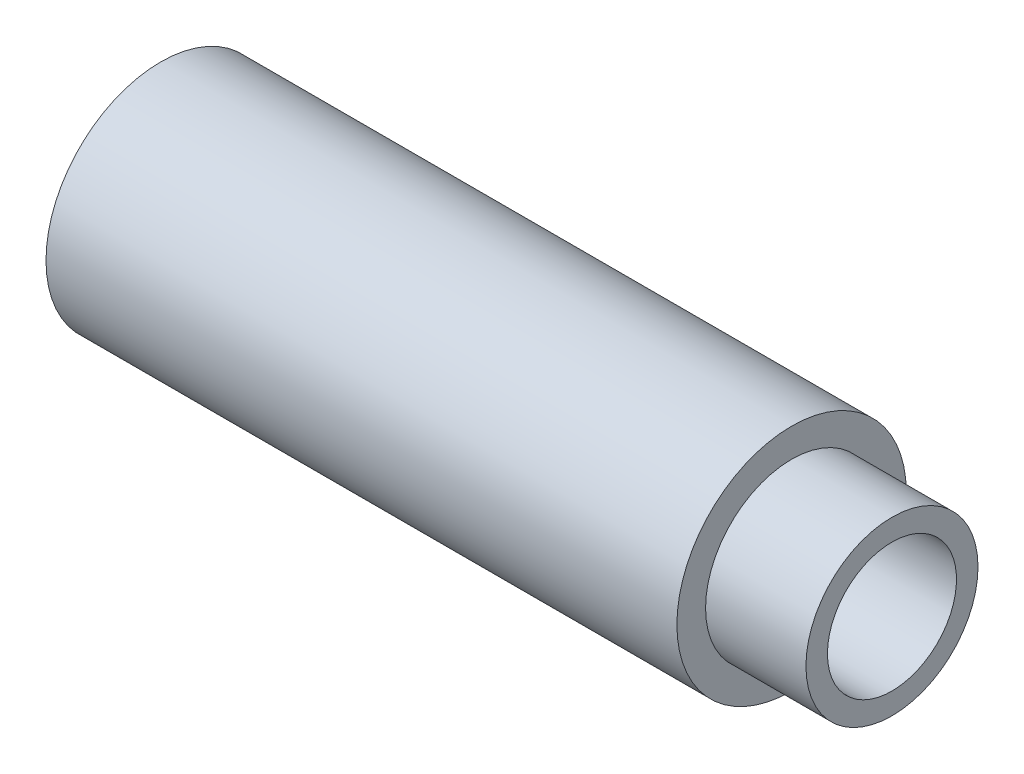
SolidWorks part; units mm, degrees
ref_plane "Front Plane" through (0, 0, 0) normal (0, 0, 1) x (1, 0, 0)
ref_plane "Top Plane" through (0, 0, 0) normal (0, 1, 0) x (1, 0, 0)
ref_plane "Right Plane" through (0, 0, 0) normal (1, 0, 0) x (0, 0, -1)
sketch "Sketch1" plane through (0, 0, 0) normal (0, 0, 1) x (1, 0, 0)
  line L0 (0, 0) -> (25.5, 0) construction
  line L1 (0, 2.25) -> (25.5, 2.25)
  line L2 (0, 2.25) -> (0, 4)
  line L3 (0, 4) -> (22, 4)
  line L4 (22, 4) -> (22, 3)
  line L5 (22, 3) -> (25.5, 3)
  line L6 (25.5, 3) -> (25.5, 2.25)
  dimension "D1" = 25.5
  dimension "D3" = 4
  dimension "D4" = 3
  dimension "D5" = 22
  dimension "D2" = 2.25
revolve "Revolve1" add sketch "Sketch1" angle 360 about L0
